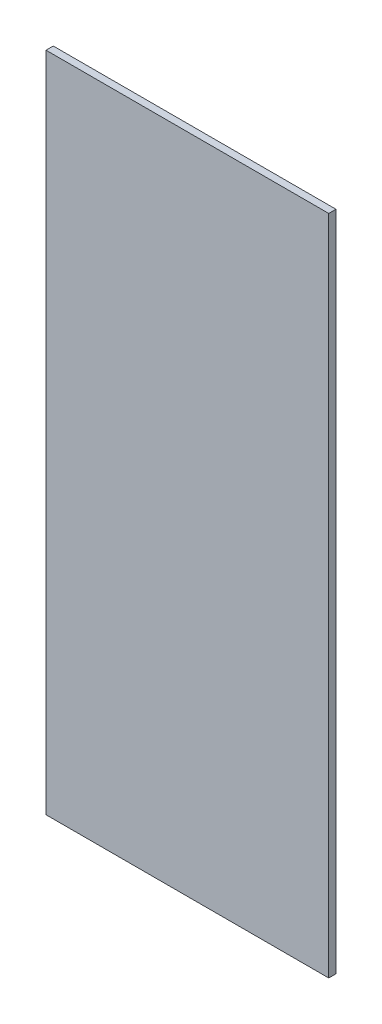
SolidWorks part; units mm, degrees
ref_plane "Alzado" through (0, 0, 0) normal (0, 0, 1) x (1, 0, 0)
ref_plane "Planta" through (0, 0, 0) normal (0, 1, 0) x (1, 0, 0)
ref_plane "Vista lateral" through (0, 0, 0) normal (1, 0, 0) x (0, 0, -1)
sketch "Croquis1" plane through (0, 0, 0) normal (0, 0, 1) x (1, 0, 0)
  line L1 (-292.5, 685) -> (292.5, 685)
  line L2 (-292.5, 685) -> (-292.5, -685)
  line L3 (-292.5, -685) -> (292.5, -685)
  line L4 (292.5, 685) -> (292.5, -685)
  line L5 (-292.5, 685) -> (292.5, -685) construction
  line L6 (-292.5, -685) -> (292.5, 685) construction
  point P0 (0, 0)
  dimension "D1" = 1370
  dimension "D2" = 585
extrude "Saliente-Extruir1" add sketch "Croquis1" along normal blind 15
